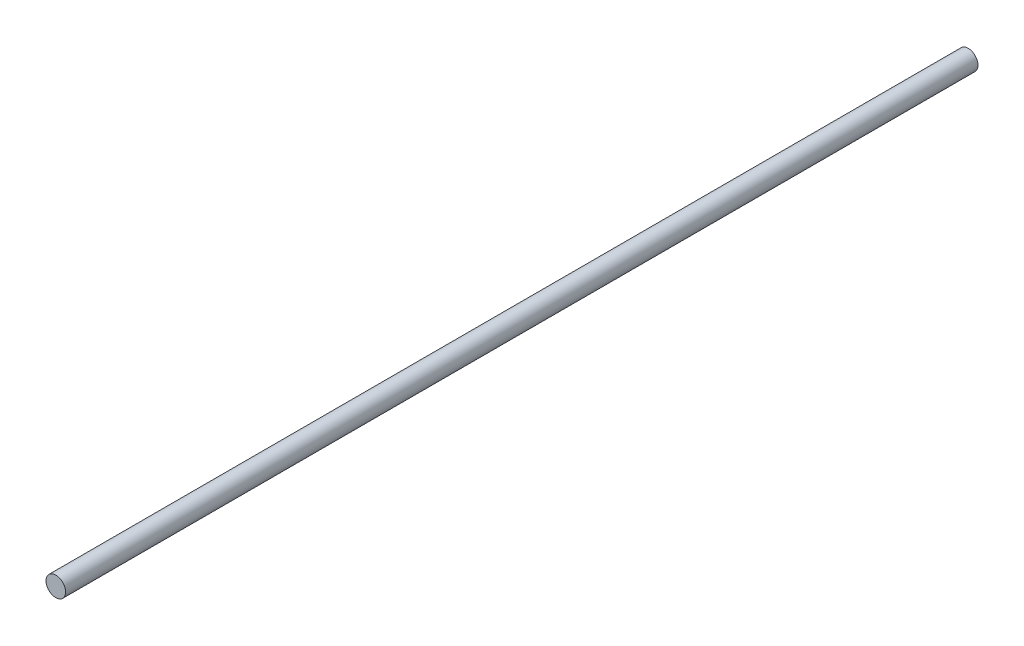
SolidWorks part; units mm, degrees
ref_plane "Front Plane" through (0, 0, 0) normal (0, 0, 1) x (1, 0, 0)
ref_plane "Top Plane" through (0, 0, 0) normal (0, 1, 0) x (1, 0, 0)
ref_plane "Right Plane" through (0, 0, 0) normal (1, 0, 0) x (0, 0, -1)
sketch "Sketch1" plane through (0, 0, 0) normal (0, 0, 1) x (1, 0, 0)
  circle A0 centre (0, 0) radius 3
extrude "Boss-Extrude1" add sketch "Sketch1" along normal blind 279.4
